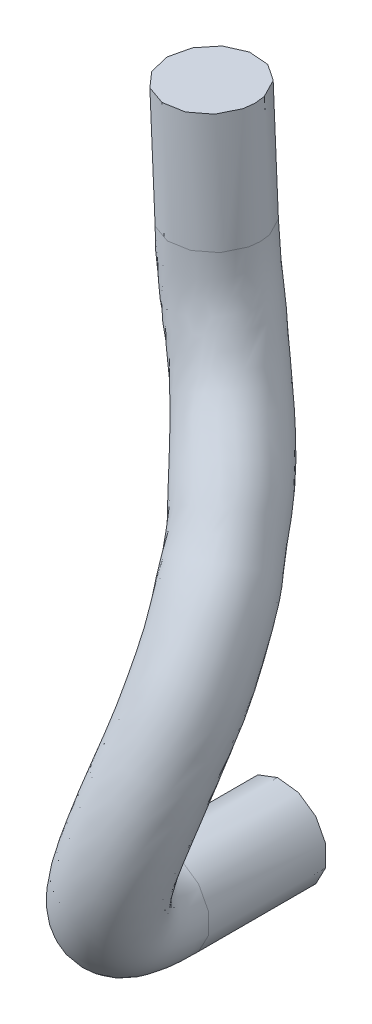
SolidWorks part; units mm, degrees
ref_plane "Front Plane" through (0, 0, 0) normal (0, 0, 1) x (1, 0, 0)
ref_plane "Top Plane" through (0, 0, 0) normal (0, 1, 0) x (1, 0, 0)
ref_plane "Right Plane" through (0, 0, 0) normal (1, 0, 0) x (0, 0, -1)
sketch3d "3DSketch1"
  line L0 (0, 0, 0) -> (0, 0, 16.906)
  line L1 (-4.2274, 94.7976, 6.1294) -> (-3.4729, 77.8785, 6.1294)
  spline S0 degree 3 poles (-3.4729, 77.8785, 6.1294) (-3.2182, 72.166, 6.1294) (1.015, 56.3274, 7.2428) (16.797, 39.7091, 24.4052) (0, 0, 33.7396) (0, 0, 16.906) knots 0 0 0 0 0.176707 0.59057 1 1 1 1
ref_plane "Plane1" through (-4.2274, 94.7976, 6.1294) normal (0.0445, -0.999, 0) x (0.999, 0.0445, 0)
sketch "Sketch4" plane through (-4.2274, 94.7976, 6.1294) normal (0.0445, -0.999, 0) x (0.999, 0.0445, 0)
  circle A0 centre (0, 0) radius 6.35
  dimension "D1" = 12.7
sweep "Sweep2" add profiles "Sketch4" path "3DSketch1"
